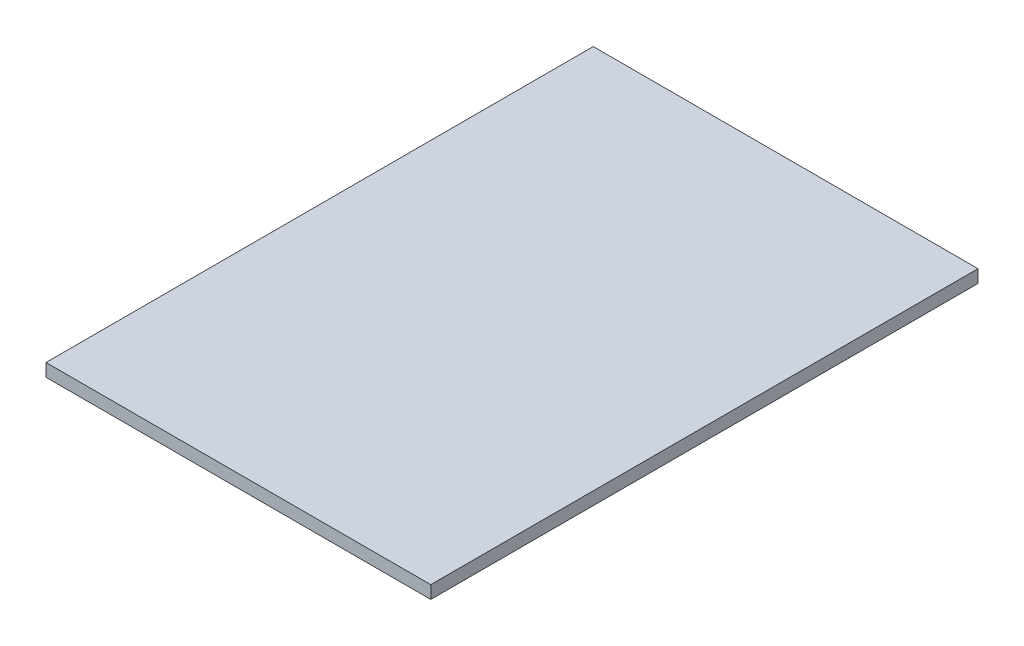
SolidWorks part; units mm, degrees
ref_plane "Front Plane" through (0, 0, 0) normal (0, 0, 1) x (1, 0, 0)
ref_plane "Top Plane" through (0, 0, 0) normal (0, 1, 0) x (1, 0, 0)
ref_plane "Right Plane" through (0, 0, 0) normal (1, 0, 0) x (0, 0, -1)
sketch "Sketch1" plane through (0, 0, 0) normal (0, 1, 0) x (1, 0, 0)
  line L1 (0, 0) -> (142.875, 0)
  line L2 (0, 0) -> (0, 203.2)
  line L3 (0, 203.2) -> (142.875, 203.2)
  line L4 (142.875, 0) -> (142.875, 203.2)
  dimension "D1" = 142.875
  dimension "D2" = 203.2
extrude "Boss-Extrude1" add sketch "Sketch1" along normal blind 4.7625
sketch "Sketch2" plane through (0, 0, 0) normal (0, 0, 1) x (1, 0, 0)
  line L0 (0, 4.7625) -> (142.875, 4.7625) construction
  line L1 (2.54, 4.445) -> (7.62, 4.445)
  line L2 (2.54, 4.445) -> (2.54, 0.3175)
  line L3 (2.54, 0.3175) -> (7.62, 0.3175)
  line L4 (7.62, 4.445) -> (7.62, 0.3175)
  line L5 (0, 0) -> (142.875, 0) construction
  line L8 (0, 4.7625) -> (0, 0) construction
  dimension "D1" = 0.3175
  dimension "D2" = 0.3175
  dimension "D3" = 2.54
  dimension "D4" = 5.08
extrude "Cut-Extrude3" [suppressed] cut sketch "Sketch2" against normal through all
pattern_linear "LPattern1" [suppressed] count 26 spacing 5.3975 count 2 spacing 5.3975
